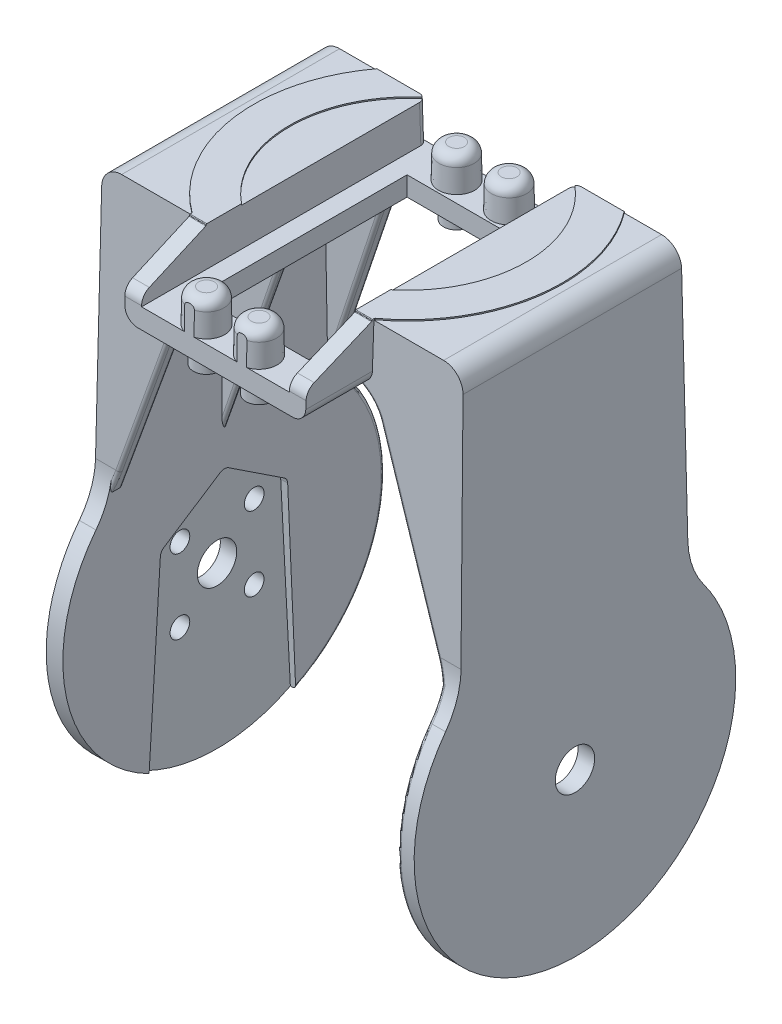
SolidWorks part; units mm, degrees
other "Solido1"
ref_plane "前视基准面" through (0, 0, 0) normal (0, 0, 1) x (1, 0, 0)
ref_plane "上视基准面" through (0, 0, 0) normal (0, 1, 0) x (1, 0, 0)
ref_plane "右视基准面" through (0, 0, 0) normal (1, 0, 0) x (0, 0, -1)
imported_body "Imported1"
other "移动面1" parameters "D1"=0.25
other "移动面2" parameters "D1"=0.25
other "移动面3" parameters "D1"=0.25
other "移动面4" parameters "D1"=0.25
other "移动面5" parameters "D1"=0.3
other "移动面6" parameters "D1"=0.3
other "移动面7" parameters "D1"=0.3
other "移动面8" parameters "D1"=0.3
